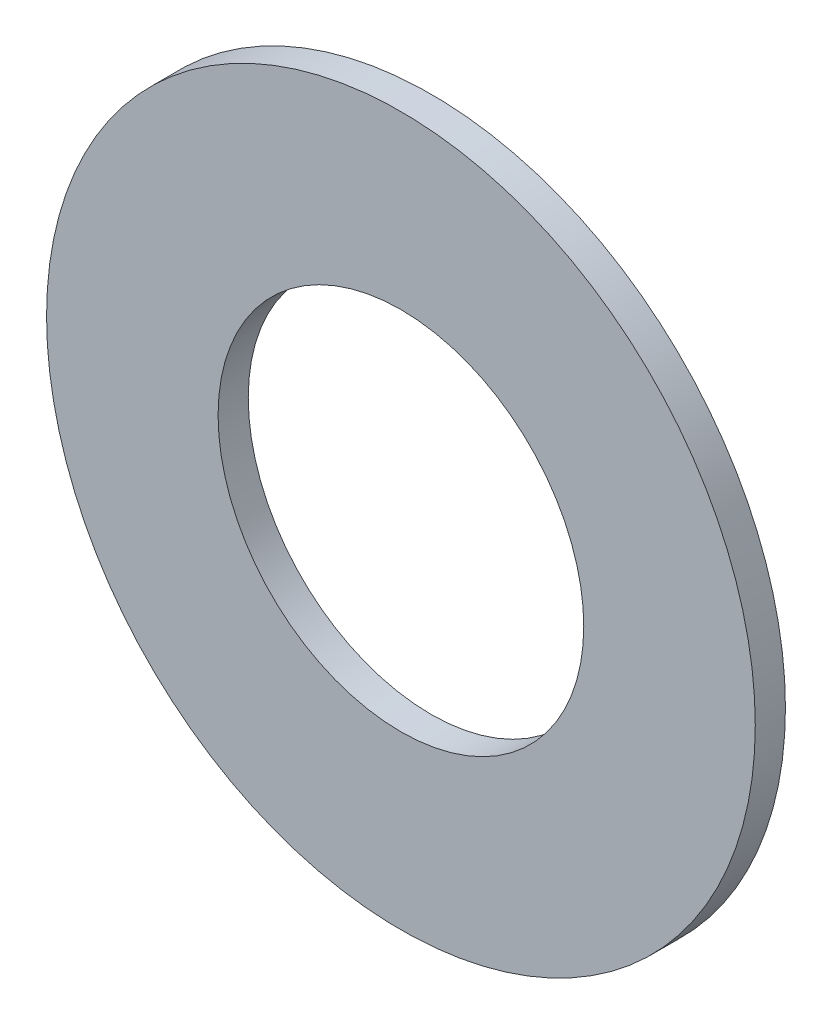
SolidWorks part; units mm, degrees
ref_plane "Front" through (0, 0, 0) normal (0, 0, 1) x (1, 0, 0)
ref_plane "Top" through (0, 0, 0) normal (0, 1, 0) x (1, 0, 0)
ref_plane "Right" through (0, 0, 0) normal (1, 0, 0) x (0, 0, -1)
sketch "Sketch1" plane through (0, 0, 0) normal (0, 0, 1) x (1, 0, 0)
  circle A0 centre (0, 0) radius 6.1595
  circle A1 centre (0, 0) radius 11.938
  dimension "D1" = 12.319
  dimension "D2" = 23.876
extrude "Base-Extrude" add sketch "Sketch1" along normal blind 1.016
